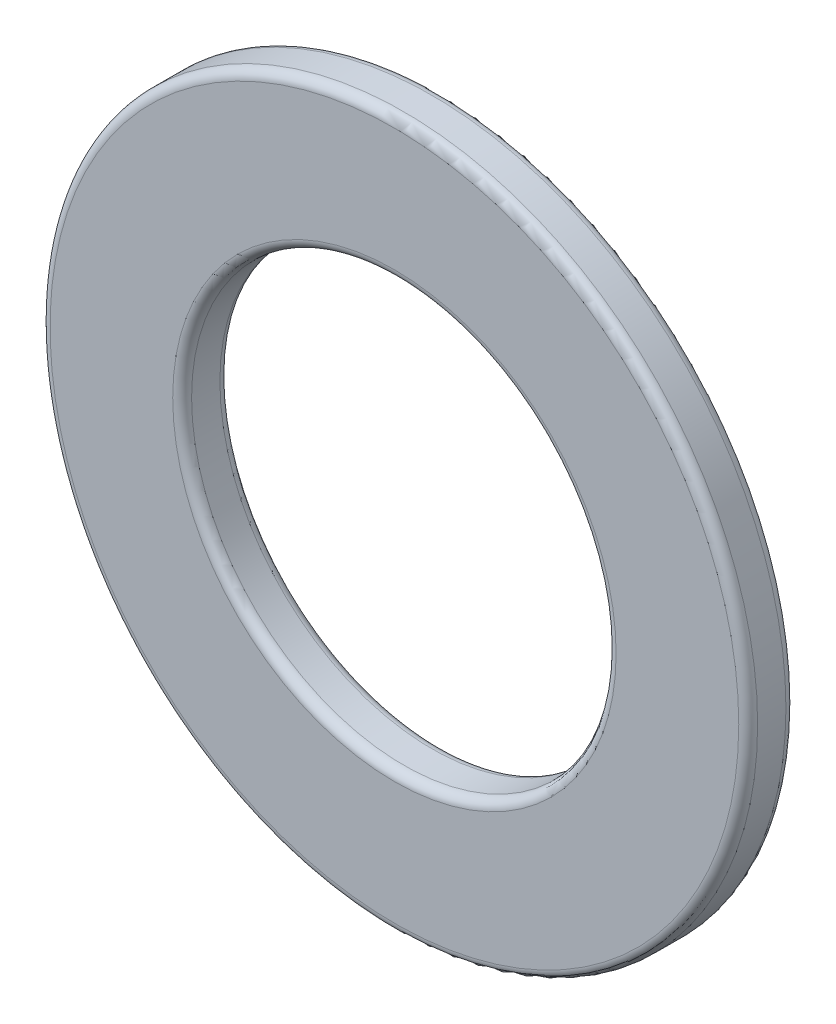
SolidWorks part; units mm, degrees
ref_plane "Спереди" through (0, 0, 0) normal (0, 0, 1) x (1, 0, 0)
ref_plane "Сверху" through (0, 0, 0) normal (0, 1, 0) x (1, 0, 0)
ref_plane "Справа" through (0, 0, 0) normal (1, 0, 0) x (0, 0, -1)
sketch "Эскиз1" plane through (0, 0, 0) normal (0, 0, 1) x (1, 0, 0)
  circle A0 centre (0, 0) radius 4.5
  circle A1 centre (0, 0) radius 7.5
  dimension "D1" = 15
  dimension "D2" = 9
extrude "Бобышка-Вытянуть1" add sketch "Эскиз1" along normal mid plane 1
fillet "Скругление1" radius 0.2 4 edges at (7.5, 0, -0.5) (7.5, 0, 0.5) (4.5, 0, -0.5) (4.5, 0, 0.5)
